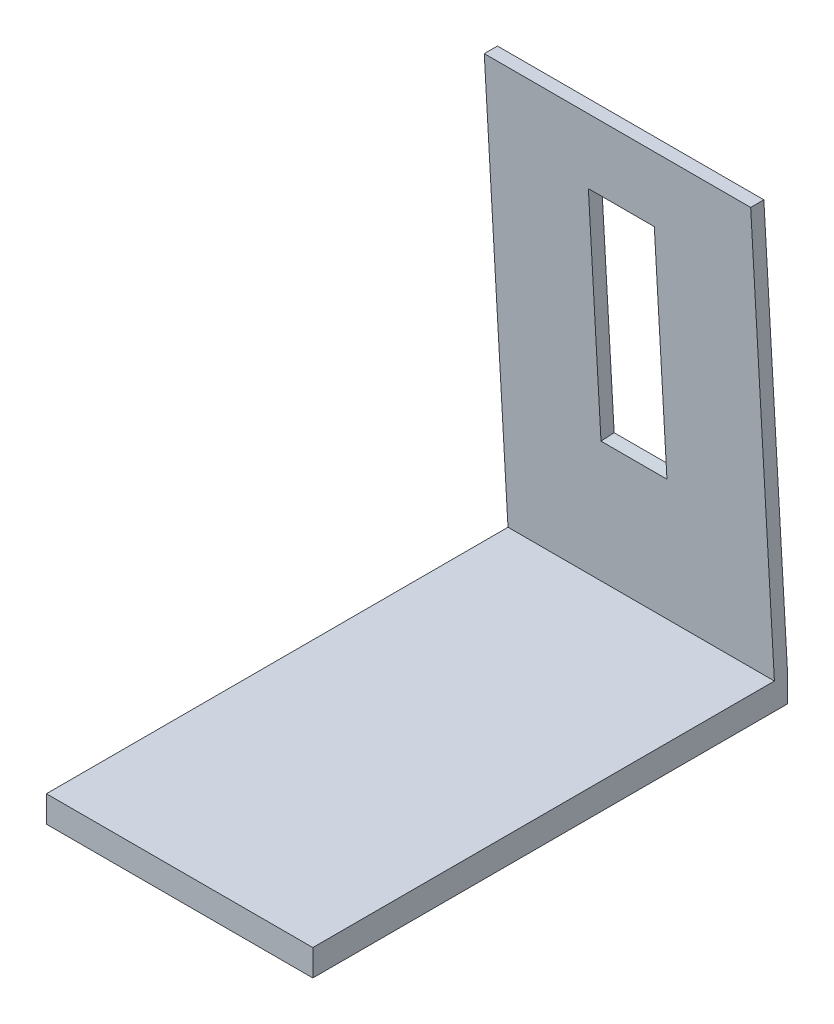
SolidWorks part; units mm, degrees
ref_plane "Front Plane" through (0, 0, 0) normal (0, 0, 1) x (1, 0, 0)
ref_plane "Top Plane" through (0, 0, 0) normal (0, 1, 0) x (1, 0, 0)
ref_plane "Right Plane" through (0, 0, 0) normal (1, 0, 0) x (0, 0, -1)
sketch "Sketch1" plane through (0, 0, 0) normal (0, 1, 0) x (1, 0, 0)
  line L1 (-6.4135, 0) -> (6.4135, 0)
  line L2 (-6.4135, 0) -> (-6.4135, 22.86)
  line L3 (-6.4135, 22.86) -> (6.4135, 22.86)
  line L4 (6.4135, 0) -> (6.4135, 22.86)
  dimension "D1" = 22.86
  dimension "D2" = 12.827
extrude "Extrude1" add sketch "Sketch1" along normal blind 1.27
sketch "Sketch2" plane through (0, 0, 0) normal (1, 0, 0) x (0, 0, -1)
  line L0 (22.86, 1.27) -> (21.717, 21.59)
  line L1 (21.717, 21.59) -> (21.082, 21.59)
  line L2 (21.082, 21.59) -> (22.225, 1.27)
  line L3 (0, 1.27) -> (22.86, 1.27) construction
  line L4 (22.225, 1.27) -> (22.86, 1.27)
  dimension "D1" = 0.635
  dimension "D2" = 20.32
  dimension "D3" = 1.143
extrude "Extrude2" add sketch "Sketch2" along normal up to surface and the other way up to surface
sketch "Sketch3" plane through (0, 1.2858, -22.8591) normal (0, 0.0562, -0.9984) x (-1, 0, 0)
  line L1 (1.5875, 6.2059) -> (-1.5875, 6.2059)
  line L2 (1.5875, 6.2059) -> (1.5875, 17.0587)
  line L3 (1.5875, 17.0587) -> (-1.5875, 17.0587)
  line L4 (-1.5875, 6.2059) -> (-1.5875, 17.0587)
  line L5 (0, 0) -> (0, 18.7389) construction
  line L7 (-6.4135, -1.2838) -> (6.4135, -1.2838) construction
  dimension "D1" = 7.4897
  dimension "D2" = 10.8528
  dimension "D3" = 3.175
extrude "Cut-Extrude1" cut sketch "Sketch3" against normal up to surface (0.634 mm away)
